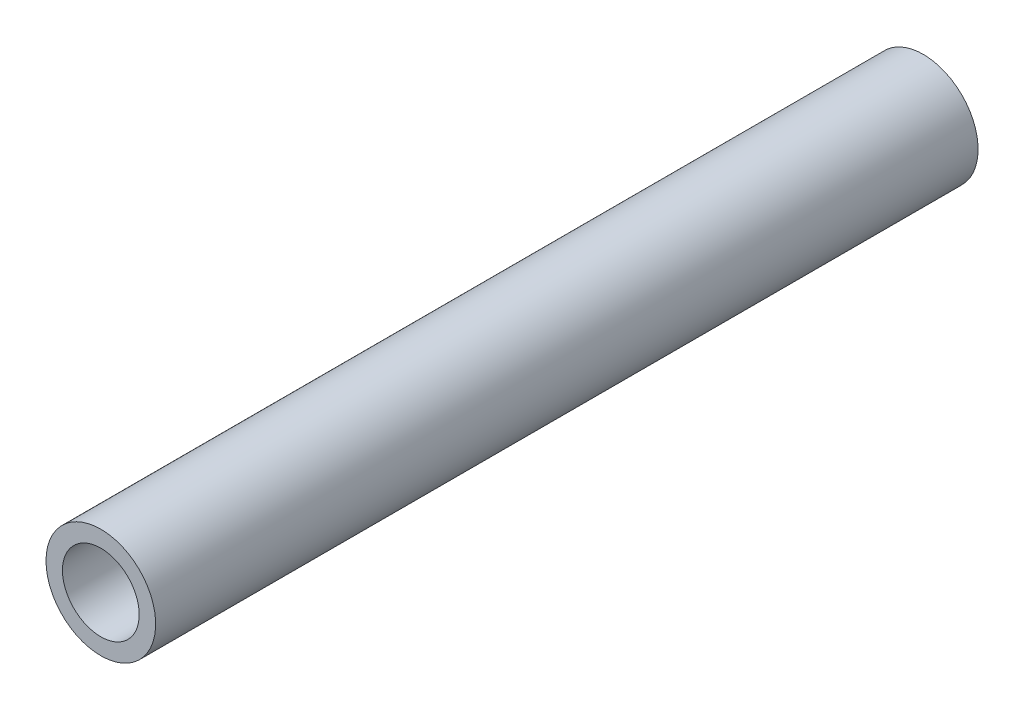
SolidWorks part; units mm, degrees
ref_plane "Front Plane" through (0, 0, 0) normal (0, 0, 1) x (1, 0, 0)
ref_plane "Top Plane" through (0, 0, 0) normal (0, 1, 0) x (1, 0, 0)
ref_plane "Right Plane" through (0, 0, 0) normal (1, 0, 0) x (0, 0, -1)
sketch "Sketch1" plane through (0, 0, 0) normal (0, 0, 1) x (1, 0, 0)
  line L0 (0, 2.1) -> (0, 3) construction
  line L1 (0, -2.1) -> (0, -3) construction
  circle A0 centre (0, 0) radius 3
  circle A1 centre (0, 0) radius 2.1
  dimension "OD" = 6
  dimension "ID" = 4.2
sketch "Sketch2" plane through (0, 0, 0) normal (1, 0, 0) x (0, 0, -1)
  line L0 (-22.5, 2.1) -> (22.5, 2.1) construction
  line L1 (-22.5, -2.1) -> (22.5, -2.1) construction
  line L2 (-22.5, -3) -> (22.5, -3) construction
  line L3 (-22.5, 3) -> (22.5, 3) construction
  dimension "Length" = 45
extrude "Extrude1" add sketch "Sketch1" along normal up to vertex (22.5 mm away) and the other way up to vertex (22.5 mm away)
sketch "Sketch3" plane through (0, 0, 22.5) normal (0, 0, 1) x (1, 0, 0)
  circle A0 centre (0, 0) radius 2.1 construction
  circle A3 centre (0, 0) radius 2.1
  point P3 (-2.1, 0)
